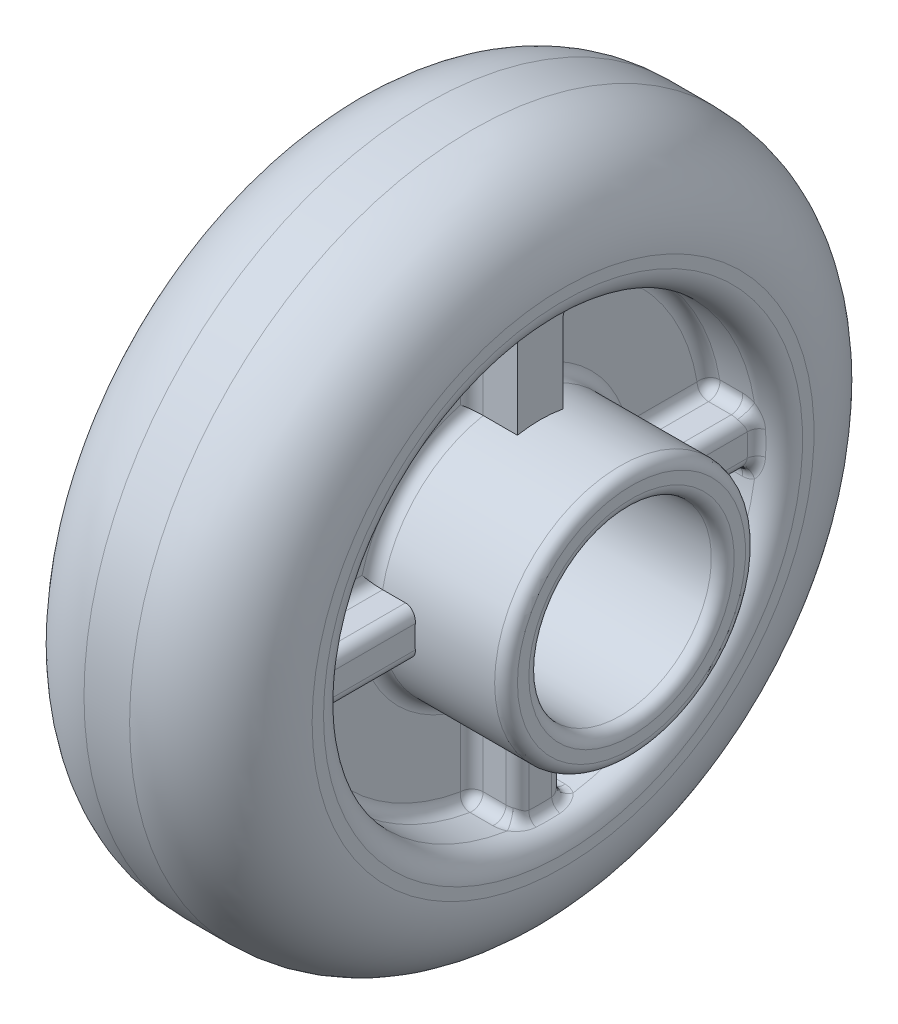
SolidWorks part; units mm, degrees
ref_plane "Face" through (0, 0, 0) normal (0, 0, 1) x (1, 0, 0)
ref_plane "Dessus" through (0, 0, 0) normal (0, 1, 0) x (1, 0, 0)
ref_plane "Droite" through (0, 0, 0) normal (1, 0, 0) x (0, 0, -1)
sketch "Esquisse1" plane through (0, 0, 0) normal (0, 0, 1) x (1, 0, 0)
  line L0 (-18.7207, 0) -> (22.2199, 0) construction
  line L1 (0, 0) -> (0, 11.083) construction
  line L2 (-2.5, 7.5) -> (-2.5, 4.75)
  line L3 (-2.5, 4.75) -> (-1, 4.75)
  line L4 (-1, 4.75) -> (-1, 2.75)
  line L5 (-1, 2.75) -> (-4, 2.75)
  line L6 (-4, 2.75) -> (-4, 2)
  line L7 (-4, 2) -> (4, 2)
  line L8 (-2.5, 7.5) -> (2.5, 7.5)
  line L9 (4, 2.75) -> (4, 2)
  line L10 (1, 2.75) -> (4, 2.75)
  line L11 (1, 4.75) -> (1, 2.75)
  line L12 (2.5, 4.75) -> (1, 4.75)
  line L13 (2.5, 7.5) -> (2.5, 4.75)
  point P14 (0, 2)
  point P19 (0, 7.75)
  dimension "D2" = 7.5
  dimension "D3" = 2
  dimension "D4" = 2.5
  dimension "D5" = 1
  dimension "D6" = 4
  dimension "D7" = 2
  dimension "D11" = 0.75
  dimension "D12" = 5
revolve "Révolution1" add sketch "Esquisse1" angle 360 about L0
fillet "Congé2" radius 0.5 2 edges at (-2.5, 0, 4.75) (2.5, 0, 4.75)
fillet "Congé3" radius 0.25 4 edges at (4, 0, 2) (4, 0, 2.75) (-4, 0, 2.75) (-4, 0, 2)
sketch "Esquisse2" plane through (1, 0, 0) normal (1, 0, 0) x (0, 0, -1)
  line L0 (0, 0) -> (0, 7.5855) construction
  line L1 (-0.5, 5.2261) -> (0.5, 5.2261)
  line L2 (-0.5, 5.2261) -> (-0.5, 2.2065)
  line L3 (-0.5, 2.2065) -> (0.5, 2.2065)
  line L4 (0.5, 5.2261) -> (0.5, 2.2065)
  circle A0 centre (0, 0) radius 5.25 construction
  dimension "D1" = 1
  dimension "D2" = 1
extrude "Extrusion1" add sketch "Esquisse2" along normal blind 1
pattern_circular "Répétition circulaire1" count 4 over 360 about axis through (0, 0, 0) along (1, 0, 0) of "Extrusion1"
mirror "Symétrie1" about plane through (0, 0, 0) normal (1, 0, 0) of "Répétition circulaire1", "Extrusion1"
fillet "Congé4" radius 0.25 14 edges at (2, -0.5, 3.7139) (2, 0.5, 3.7139) (2, 0.5, -3.7139) (2, -0.5, -3.7139) (2, -3.7139, -0.5) (2, -3.7139, 0.5) (-2, 0.5, 3.7139) (-2, -0.5, 3.7139) (-2, -3.7139, 0.5) (-2, -3.7139, -0.5) (-2, -0.5, -3.7139) (-2, 0.5, -3.7139) (-2, 3.7139, -0.5) (-2, 3.7139, 0.5)
fillet "Congé5" radius 0.25 69 edges at (-1, 3.7139, 0.5) (-1, 3.3588, 3.3588) (-1, 0.5, 3.7139) (-1, 1.9445, 1.9445) (-1, 3.7139, -0.5) (-1, 1.9445, -1.9445) (-1, 0.5, -3.7139) (-1, 3.3588, -3.3588) (-1, -3.7139, -0.5) (-1, -3.3588, -3.3588) (-1, -0.5, -3.7139) (-1, -1.9445, -1.9445) (-1, -0.5, 3.7139) (-1, -3.3588, 3.3588) (-1, -3.7139, 0.5) (-1, -1.9445, 1.9445) (1, 1.9445, -1.9445) (1, 3.7139, -0.5) (1, 3.3588, -3.3588) (1, 0.5, -3.7139) (1, 3.3588, 3.3588) (1, 3.7139, 0.5) (1, 1.9445, 1.9445) (1, 0.5, 3.7139) (1, -3.3588, 3.3588) (1, -0.5, 3.7139) (1, -1.9445, 1.9445) (1, -3.7139, 0.5) (1, -3.3588, -3.3588) (1, -3.7139, -0.5) (1, -1.9445, -1.9445) (1, -0.5, -3.7139) (2, 0, -4.75) (2, 0, 4.75) (2, -4.75, 0) (-2, 4.75, 0) (-2, 0, -4.75) (-2, 0, 4.75) (-2, -4.75, 0) (1.9451, -0.4063, -4.7326) (1.9056, -4.729, -0.4457) (1.375, -4.7236, -0.5) (1.375, -0.5, -4.7236) (1.5, 4.7236, -0.5) (1.9056, 0.4457, -4.729) (1.375, 0.5, -4.7236) (1.9451, 0.4063, 4.7326) (1.5, 4.7236, 0.5) (1.375, 0.5, 4.7236) (1.9451, -4.7326, 0.4063) (1.9056, -0.4457, 4.729) (1.375, -0.5, 4.7236) (1.375, -4.7236, 0.5) (-1.375, 4.7236, 0.5) (-1.9451, 4.7326, 0.4063) (-1.9056, 0.4457, 4.729) (-1.375, 0.5, 4.7236) (-1.9056, 4.729, -0.4457) (-1.375, 4.7236, -0.5) (-1.375, 0.5, -4.7236) (-1.9451, 0.4063, -4.7326) (-1.375, -4.7236, -0.5) (-1.9451, -4.7326, -0.4063) (-1.9056, -0.4457, -4.729) (-1.375, -0.5, -4.7236) (-1.375, -0.5, 4.7236) (-1.9451, -0.4063, 4.7326) (-1.9056, -4.729, 0.4457) (-1.375, -4.7236, 0.5)
fillet "Congé6" radius 2 2 edges at (2.5, 0, 7.5) (-2.5, 0, 7.5)
